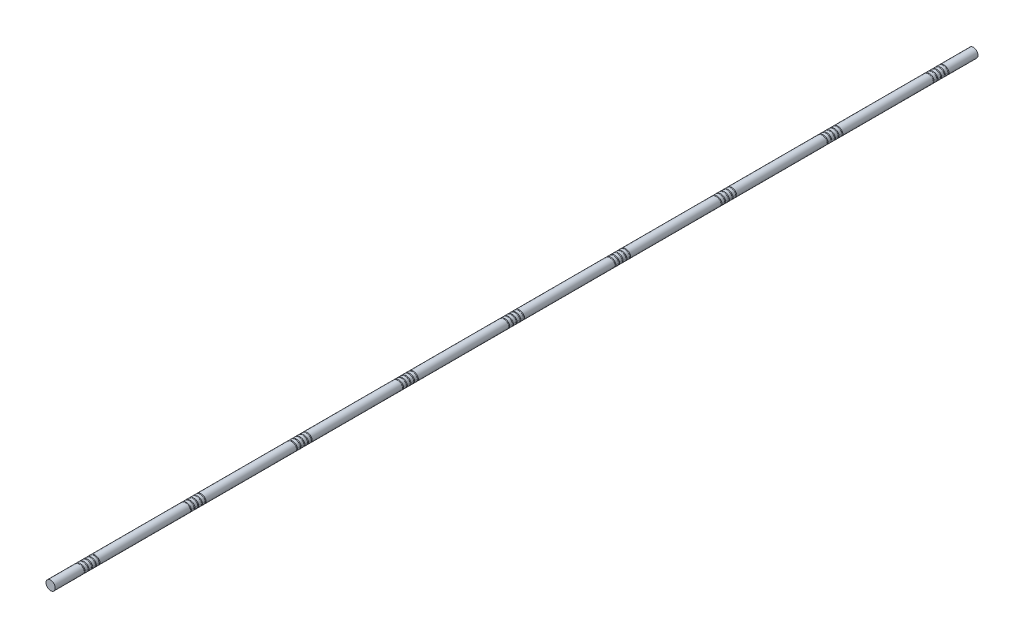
SolidWorks part; units mm, degrees
ref_plane "Front Plane" through (0, 0, 0) normal (0, 0, 1) x (1, 0, 0)
ref_plane "Top Plane" through (0, 0, 0) normal (0, 1, 0) x (1, 0, 0)
ref_plane "Right Plane" through (0, 0, 0) normal (1, 0, 0) x (0, 0, -1)
sketch "Sketch1" plane through (0, 0, 0) normal (0, 0, 1) x (1, 0, 0)
  circle A0 centre (0, 0) radius 25
  dimension "D1" = 50
extrude "Boss-Extrude1" add sketch "Sketch1" along normal blind 5000
ref_plane "Plane1" through (0, 0, 150) normal (0, 0, 1) x (1, 0, 0)
sketch "Sketch2" plane through (0, 0, 150) normal (0, 0, 1) x (1, 0, 0)
  circle A0 centre (0, 0) radius 27.1167
  dimension "D1" = 54.2333
curve "Helix/Spiral1"
sketch "Sketch3" plane through (0, 0, 0) normal (0, 1, 0) x (1, 0, 0)
  circle A0 centre (-27.1167, -150) radius 3.175
  spline S0 degree 3 number of poles 118 (-27.1167, -150) -> (-27.1167, -250) construction
  dimension "D1" = 6.35
sweep "Cut-Sweep1" cut profiles "Sketch3" path "Helix/Spiral1"
pattern_linear "LPattern1" count 9 spacing 575 along (0, 0, -1) of "Cut-Sweep1"
